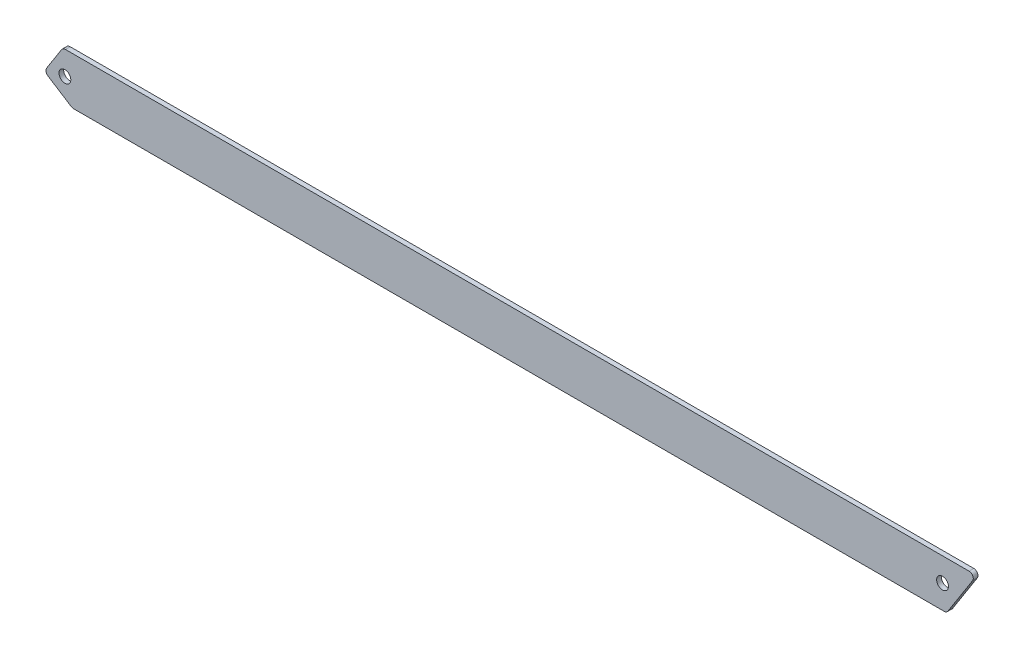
SolidWorks part; units mm, degrees
ref_plane "FRONT" through (0, 0, 0) normal (0, 0, 1) x (1, 0, 0)
ref_plane "TOP" through (0, 0, 0) normal (0, 1, 0) x (1, 0, 0)
ref_plane "RIGHT" through (0, 0, 0) normal (1, 0, 0) x (0, 0, -1)
sketch "Sketch1" plane through (0, 0, 0) normal (0, 0, 1) x (1, 0, 0)
  line L0 (-4.5618, 28.8119) -> (-24.4055, -2.3366)
  line L1 (-22.4619, -11.104) -> (8.3849, -30.7555)
  line L2 (11.7968, -31.75) -> (1181.1, -31.75)
  line L3 (1186.4555, -28.8119) -> (1219.5061, 23.0671)
  line L4 (1214.7425, 31.75) -> (0.7937, 31.75)
  line L5 (-18.9699, 0) -> (23.5619, 0) construction
  line L6 (1179.1156, 16.3163) -> (1179.1156, -16.4533) construction
  line L7 (0, 21.98) -> (0, -62.1006) construction
  line L9 (1214.103, 0) -> (1137.7724, 0) construction
  arc A0 (-24.4055, -2.3366) -> (-22.4619, -11.104) centre (-19.05, -5.7484) ccw
  arc A1 (8.3849, -30.7555) -> (11.7968, -31.75) centre (11.7968, -25.4) ccw
  arc A2 (1181.1, -31.75) -> (1186.4555, -28.8119) centre (1181.1, -25.4) ccw
  arc A3 (1219.5061, 23.0671) -> (1214.7425, 31.75) centre (1214.7425, 26.1019) ccw
  arc A4 (0.7937, 31.75) -> (-4.5618, 28.8119) centre (0.7937, 25.4) ccw
  circle A5 centre (0, 0) radius 7.9375
  circle A6 centre (1179.1156, 0) radius 7.9375
  dimension "D1" = 1245.7906
  dimension "D6" = 15.875
  dimension "D7" = 6.35
  dimension "D8" = 6.35
  dimension "D9" = 6.35
  dimension "D16" = 6.35
  dimension "D11" = 15.875
  dimension "D2" = 1179.1156
  dimension "D3" = 63.5
  dimension "D4" = 32.5
  dimension "D5" = 32.5
  dimension "D10" = 19.05
  dimension "D12" = 0.7937
  dimension "D13" = 1181.1
  dimension "D14" = 32.5
sheet metal parameters "Sheet-Metal1" thickness 6.35 parameters "D1"=4.7625
base flange "Base-Flange1" sketch "Sketch1" thickness 6.35 reverse thickness direction no parameters "D1"=4.7625
flat pattern "Flat-Pattern1"
sketch "Bend-Lines1" plane through (0, 0, 0) normal (0, 1, 0) x (-1, 0, 0)
